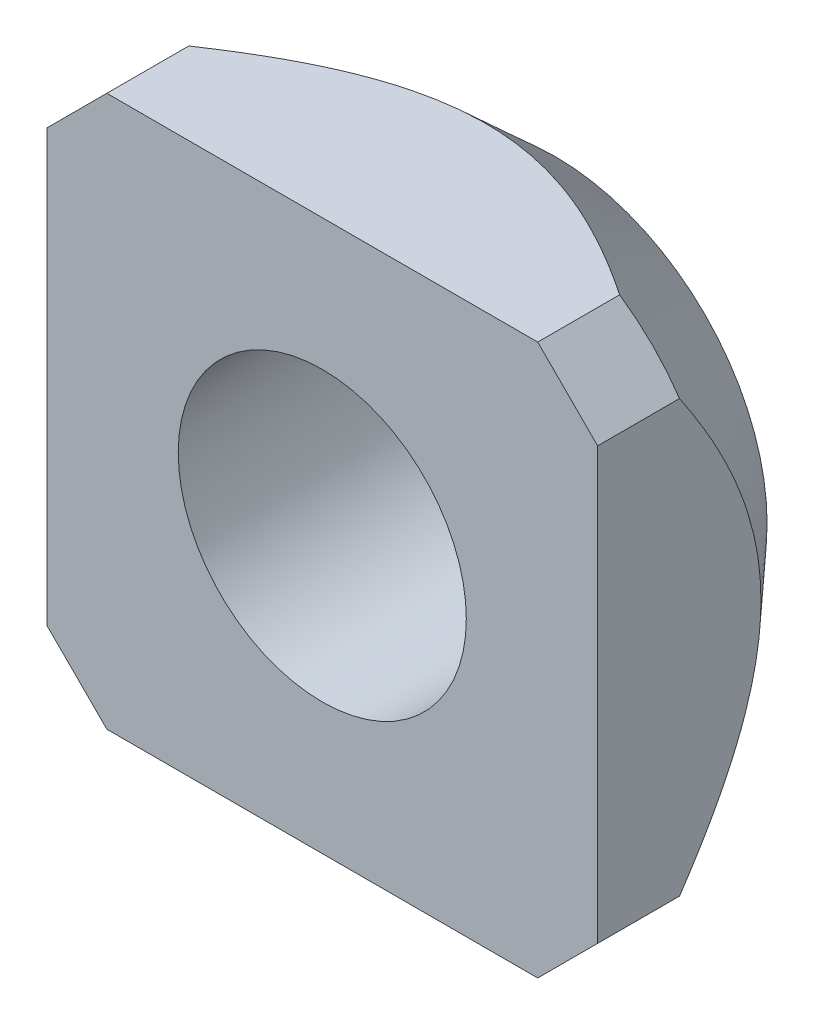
SolidWorks part; units mm, degrees
ref_plane "Front" through (0, 0, 0) normal (0, 0, 1) x (1, 0, 0)
ref_plane "Top" through (0, 0, 0) normal (0, 1, 0) x (1, 0, 0)
ref_plane "Right" through (0, 0, 0) normal (1, 0, 0) x (0, 0, -1)
imported_body "Imported1"
hole_wizard "M8x1.25 Tapped Hole1" positions "3DSketch1" profile "Sketch1" tap size "M8x1.25" standard "Ansi Metric"
sketch3d "3DSketch1"
  line L0 (-6.5, 5.0858, 0) -> (-6.5, -5.0858, 0) construction
  line L1 (5.0858, 6.5, 0) -> (-5.0858, 6.5, 0) construction
  point P0 (0, 0, 0)
  dimension "D1" = 6.5
  dimension "D2" = 6.5
sketch "Sketch1" plane through (0, 0, 0) normal (1, 0, 0) x (0, -1, 0)
  line L0 (0, 0) -> (0, 24.2929)
  line L1 (0, 24.2929) -> (3.4, 22.25)
  line L2 (3.4, 22.25) -> (3.4, 0)
  line L5 (3.4, 0) -> (0, 0)
  line L10 (0, 24.2929) -> (-3.4, 22.25) construction
  line L11 (0, -6.35) -> (0, 107.95) construction
  dimension "Tap Drill Dia." = 6.8
  dimension "Tap Drill Depth" = 22.25
  dimension "Drill Angle" = 118
